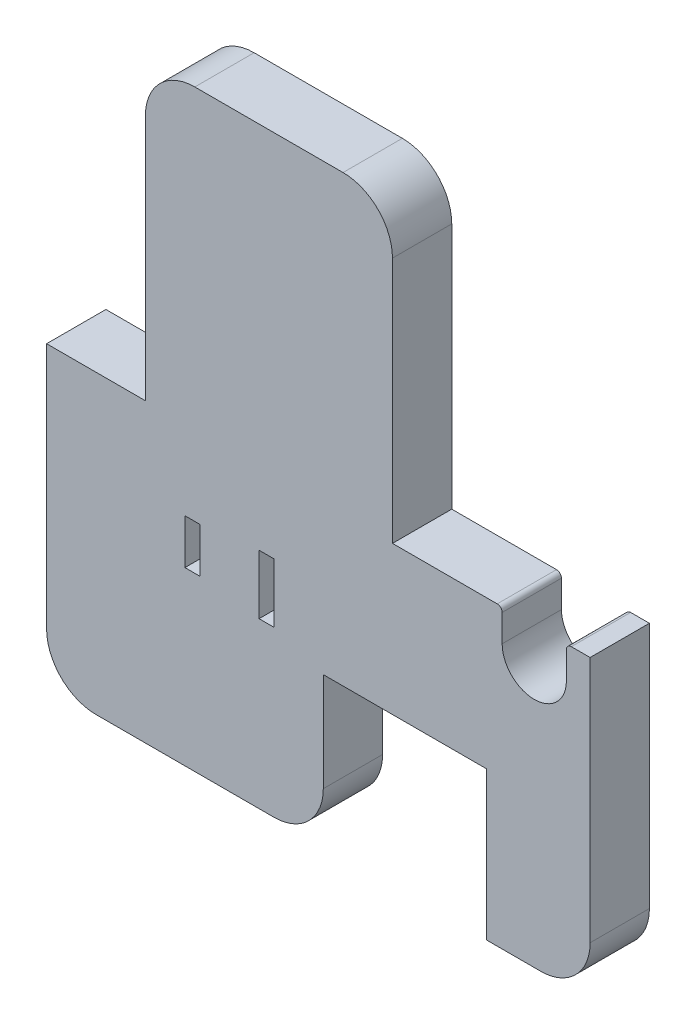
SolidWorks part; units mm, degrees
ref_plane "Front Plane" through (0, 0, 0) normal (0, 0, 1) x (1, 0, 0)
ref_plane "Top Plane" through (0, 0, 0) normal (0, 1, 0) x (1, 0, 0)
ref_plane "Right Plane" through (0, 0, 0) normal (1, 0, 0) x (0, 0, -1)
sketch "Sketch1" plane through (0, 0, 0) normal (0, 0, 1) x (1, 0, 0)
  line L0 (-45, 30) -> (-45, -30)
  line L1 (-45, -30) -> (11, -30)
  line L2 (11, -30) -> (11, 0)
  line L3 (11, 0) -> (44, 0)
  line L4 (44, 0) -> (44, -30)
  line L5 (44, -30) -> (65, -30)
  line L6 (65, -30) -> (65, 30)
  line L7 (65, 30) -> (25, 30)
  line L8 (25, 30) -> (25, 90)
  line L9 (25, 90) -> (-25, 90)
  line L10 (-25, 90) -> (-25, 30)
  line L11 (-25, 30) -> (-45, 30)
  line L12 (-8, 50.2093) -> (-8, 9.8788) construction
  line L13 (-17, 13.845) -> (-14, 13.845)
  line L14 (-17, 13.845) -> (-17, 4.755)
  line L15 (-17, 4.755) -> (-14, 4.755)
  line L16 (-14, 13.845) -> (-14, 4.755)
  line L17 (-2, 15.3) -> (1, 15.3)
  line L18 (-2, 15.3) -> (-2, 3.3)
  line L19 (-2, 3.3) -> (1, 3.3)
  line L20 (1, 15.3) -> (1, 3.3)
  point P2 (0, 90)
  point P13 (-45, 0)
  point P24 (-17, 9.3)
  point P27 (-8, 30.044)
  point P28 (1, 9.3)
  dimension "D1" = 50
  dimension "D2" = 60
  dimension "D3" = 60
  dimension "D4" = 33
  dimension "D5" = 30
  dimension "D6" = 36
  dimension "D7" = 20
  dimension "D8" = 40
  dimension "D9" = 12
  dimension "D10" = 9.09
  dimension "D11" = 3
  dimension "D12" = 3
  dimension "D13" = 12
  dimension "D14" = 17
  dimension "D15" = 14.7
extrude "Boss-Extrude1" add sketch "Sketch1" against normal blind 12
fillet "Fillet1" radius 10 4 edges at (25, 90, -6) (-25, 90, -6) (65, -30, -6) (-45, -30, -6)
fillet "Fillet2" radius 10 1 edges at (11, -30, -6)
sketch "Sketch2" plane through (0, 0, 0) normal (0, 0, 1) x (1, 0, 0)
  line L2 (60.2, 23.5) -> (60.2, 30)
  line L3 (47.2, 30) -> (47.2, 23.5)
  line L5 (65, -20) -> (65, 30) construction
  line L6 (65, 30) -> (25, 30) construction
  line L7 (47.2, 30) -> (60.2, 30)
  arc A1 (47.2, 23.5) -> (60.2, 23.5) centre (53.7, 23.5) ccw
  point P7 (53.7, 17)
  point P11 (0, 0)
  dimension "D1" = 13
  dimension "D2" = 4.8
extrude "Cut-Extrude1" cut sketch "Sketch2" against normal blind 25
fillet "Fillet3" radius 1 2 edges at (60.2, 30, -6) (47.2, 30, -6)
